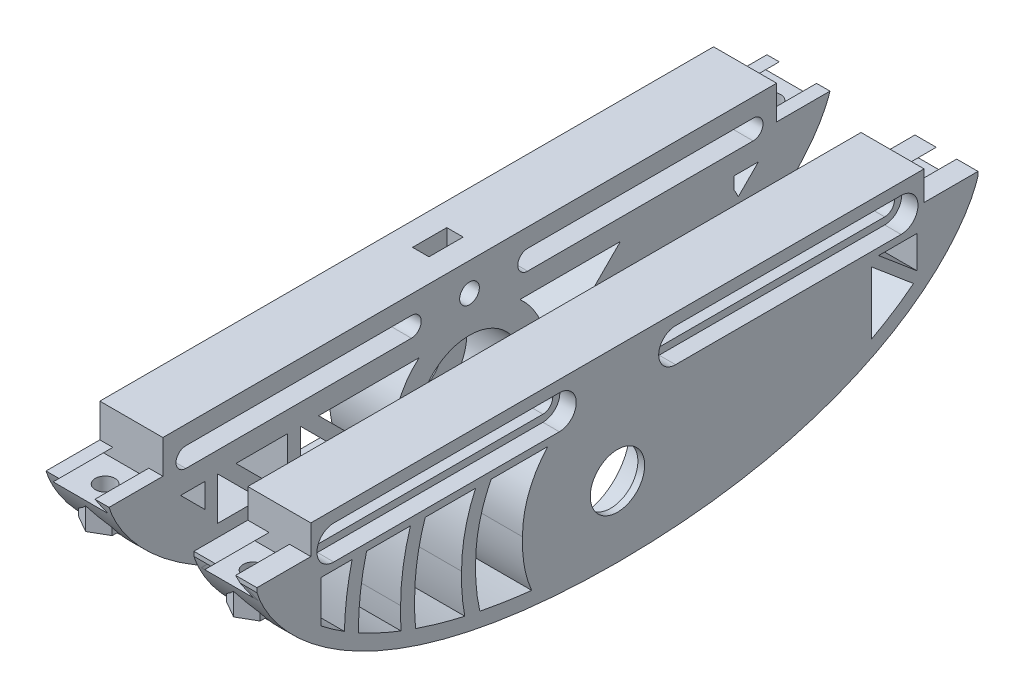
SolidWorks part; units mm, degrees
ref_plane "Front Plane" through (0, 0, 0) normal (0, 0, 1) x (1, 0, 0)
ref_plane "Top Plane" through (0, 0, 0) normal (0, 1, 0) x (1, 0, 0)
ref_plane "Right Plane" through (0, 0, 0) normal (1, 0, 0) x (0, 0, -1)
sketch "Sketch1" plane through (0, 0, 0) normal (0, 1, 0) x (1, 0, 0)
  line L0 (9.0549, 62.1087) -> (22.5, 62.1087) construction
  line L1 (-22.5, -77.5) -> (22.5, -77.5)
  line L2 (-22.5, -77.5) -> (-22.5, 77.5)
  line L3 (-22.5, 77.5) -> (22.5, 77.5)
  line L4 (22.5, -77.5) -> (22.5, 77.5)
  line L5 (-22.5, -77.5) -> (22.5, 77.5) construction
  line L6 (-22.5, 77.5) -> (22.5, -77.5) construction
  line L7 (-9.0549, -71) -> (9.0549, -71)
  line L8 (-9.0549, -71) -> (-9.0549, 71)
  line L9 (-9.0549, 71) -> (9.0549, 71)
  line L10 (9.0549, -71) -> (9.0549, 71)
  line L11 (-9.0549, -71) -> (9.0549, 71) construction
  line L12 (-9.0549, 71) -> (9.0549, -71) construction
  line L13 (22.5, 0) -> (30.5303, 0) construction
  line L14 (0, 71) -> (0, 63.7491) construction
  circle A0 centre (15.7774, 71) radius 2.1
  circle A1 centre (15.7774, -71) radius 2.1
  circle A2 centre (-15.7774, -71) radius 2.1
  circle A3 centre (-15.7774, 71) radius 2.1
  point P0 (0, 0)
  point P6 (0, 0)
  dimension "D4" = 4.2
  dimension "D1" = 45
  dimension "D2" = 155
  dimension "D3" = 142
extrude "Boss-Extrude1" add sketch "Sketch1" along normal blind 3.85
sketch "Sketch2" plane through (22.5, 0, 0) normal (1, 0, 0) x (0, 0, -1)
  line L0 (0, -36.15) -> (0, -37.8485) construction
  line L1 (0, -32.15) -> (-8.9497, -32.15) construction
  line L2 (-60.5001, -2.2123) -> (-12.3944, -2.2123) construction
  line L3 (-60.5001, -0.1123) -> (-12.3944, -0.1123)
  line L4 (-60.5001, -4.3123) -> (-12.3944, -4.3123)
  line L5 (0, 3.85) -> (0, 7.9942) construction
  line L6 (-77.5, 3.85) -> (77.5, 3.85) construction
  line L7 (60.5001, -2.2123) -> (12.3944, -2.2123) construction
  line L8 (60.5001, -0.1123) -> (12.3944, -0.1123)
  line L9 (60.5001, -4.3123) -> (12.3944, -4.3123)
  line L10 (61.6288, -8.735) -> (56.4489, -13.9148)
  line L11 (-10.743, -8.735) -> (-32.1809, -8.735)
  line L12 (-32.1809, -8.735) -> (-15.8727, -25.0432)
  line L13 (-36.07, -8.735) -> (-18.3961, -26.4088)
  line L14 (-18.3961, -26.4088) -> (-36.07, -26.4088)
  line L15 (-36.07, -26.4088) -> (-36.07, -8.735)
  line L16 (-38.82, -8.735) -> (-38.82, -19.7248)
  line L17 (-38.82, -19.7248) -> (-49.8099, -8.735)
  line L18 (-49.8099, -8.735) -> (-38.82, -8.735)
  line L19 (-53.6989, -8.735) -> (-44.5827, -17.8512)
  line L20 (-44.5827, -17.8512) -> (-53.6989, -17.8512)
  line L21 (-53.6989, -17.8512) -> (-53.6989, -8.735)
  line L22 (-56.4489, -13.9148) -> (-56.4489, -8.735)
  line L23 (-56.4489, -8.735) -> (-61.6288, -8.735)
  line L24 (-61.6288, -8.735) -> (-56.4489, -13.9148)
  line L25 (-32.1809, -8.735) -> (-80.3886, -8.735) construction
  line L26 (56.4489, -13.9148) -> (56.4489, -8.735)
  line L27 (53.6989, -17.8512) -> (53.6989, -8.735)
  line L28 (44.5827, -17.8512) -> (53.6989, -17.8512)
  line L29 (53.6989, -8.735) -> (44.5827, -17.8512)
  line L30 (49.8099, -8.735) -> (38.82, -8.735)
  line L31 (38.82, -19.7248) -> (49.8099, -8.735)
  line L32 (38.82, -8.735) -> (38.82, -19.7248)
  line L33 (36.07, -26.4088) -> (36.07, -8.735)
  line L34 (18.3961, -26.4088) -> (36.07, -26.4088)
  line L35 (36.07, -8.735) -> (18.3961, -26.4088)
  line L36 (32.1809, -8.735) -> (15.8727, -25.0432)
  line L37 (10.743, -8.735) -> (32.1809, -8.735)
  line L38 (56.4489, -8.735) -> (61.6288, -8.735)
  circle A0 centre (0, -21.075) radius 11.075
  circle A1 centre (0, -2.2123) radius 2.1
  arc A2 (-60.5001, -0.1123) -> (-60.5001, -4.3123) centre (-60.5001, -2.2123) ccw
  arc A3 (-12.3944, -4.3123) -> (-12.3944, -0.1123) centre (-12.3944, -2.2123) ccw
  arc A4 (60.5001, -0.1123) -> (60.5001, -4.3123) centre (60.5001, -2.2123) cw
  arc A5 (12.3944, -4.3123) -> (12.3944, -0.1123) centre (12.3944, -2.2123) cw
  arc A6 (-10.743, -8.735) -> (-15.8727, -25.0432) centre (0, -21.075) ccw
  arc A7 (10.743, -8.735) -> (15.8727, -25.0432) centre (0, -21.075) cw
  spline S0 degree 3 poles (0, -36.15) (-57.8718, -36.025) (-77.0889, -10.6303) (-77.5, 0) knots 0 0 0 0 1 1 1 1
  spline S1 degree 3 poles (0, -36.15) (57.8718, -36.025) (77.0889, -10.6303) (77.5, 0) knots 0 0 0 0 1 1 1 1
  point P14 (-36.4473, -2.2123)
  point P25 (36.4473, -2.2123)
  dimension "D1" = 22.15
  dimension "D2" = 4.2
  dimension "D4" = 2.1
  dimension "D3" = 4
  dimension "D5" = 45
  dimension "D6" = 45
  dimension "D7" = 45
  dimension "D8" = 2.75
  dimension "D9" = 2.75
  dimension "D10" = 2.75
  dimension "D11" = 2.75
  dimension "D12" = 40
extrude "Boss-Extrude2" add sketch "Sketch2" against normal up to surface (31.5549 mm away) contours S0 S1 L11 A6 L12 L9 A5 L8 A4 L26 L38 L10 L20 L21 L19 L17 L18 L16 L14 L15 L13 L24 L23 L22 L29 L27 L28 L32 L30 L31 L35 L33 L34 A0 A1 A3 L4 M16
mirror "Mirror9" about plane through (0, 0, 0) normal (1, 0, 0) of "Boss-Extrude2"
sketch "Sketch4" plane through (0, 0, 0) normal (0, 1, 0) x (1, 0, 0)
  line L1 (9.0549, 71) -> (-9.0549, 71)
  line L2 (9.0549, 71) -> (9.0549, -71)
  line L3 (9.0549, -71) -> (-9.0549, -71)
  line L4 (-9.0549, 71) -> (-9.0549, -71)
  circle A0 centre (15.7774, -71) radius 2.1
  circle A1 centre (-15.7774, -71) radius 2.1
  circle A2 centre (15.7774, 71) radius 2.1
  circle A3 centre (-15.7774, 71) radius 2.1
extrude "Cut-Extrude1" cut sketch "Sketch4" against normal through all
sketch "Sketch5" plane through (0, 0, 77.5) normal (0, 0, 1) x (1, 0, 0)
  line L0 (-22.5, 0) -> (22.5, 0) construction
  line L1 (-9.0549, -13.0689) -> (9.0549, -13.0689)
  line L2 (-9.0549, -13.0689) -> (-9.0549, 0)
  line L3 (-9.0549, 0) -> (9.0549, 0)
  line L4 (9.0549, -13.0689) -> (9.0549, 0)
extrude "Cut-Extrude2" cut sketch "Sketch5" against normal through all
sketch "Sketch6" plane through (22.5, 0, 0) normal (1, 0, 0) x (0, 0, -1)
  line L0 (-60.5001, -2.2123) -> (-12.3944, -2.2123) construction
  line L1 (-60.5001, 1.3877) -> (-12.3944, 1.3877)
  line L2 (-60.5001, -5.8123) -> (-12.3944, -5.8123)
  line L3 (0, -0.1123) -> (0, -1.2356) construction
  line L4 (60.5001, -2.2123) -> (12.3944, -2.2123) construction
  line L5 (60.5001, 1.3877) -> (12.3944, 1.3877)
  line L6 (60.5001, -5.8123) -> (12.3944, -5.8123)
  arc A0 (-60.5001, 1.3877) -> (-60.5001, -5.8123) centre (-60.5001, -2.2123) ccw
  arc A1 (-12.3944, -5.8123) -> (-12.3944, 1.3877) centre (-12.3944, -2.2123) ccw
  circle A2 centre (0, -2.2123) radius 2.1 construction
  arc A3 (60.5001, 1.3877) -> (60.5001, -5.8123) centre (60.5001, -2.2123) cw
  arc A4 (12.3944, -5.8123) -> (12.3944, 1.3877) centre (12.3944, -2.2123) cw
  point P4 (-36.4473, -2.2123)
  point P16 (36.4473, -2.2123)
  dimension "D1" = 3.6
extrude "Cut-Extrude3" cut sketch "Sketch6" against normal blind 3.5
ref_plane "Plane1" through (0, -35, 0) normal (0, -1, 0) x (-1, 0, 0)
ref_plane "Plane2" through (0, -1.15, 0) normal (0, 1, 0) x (1, 0, 0)
mirror "Mirror10" about plane through (0, 0, 0) normal (1, 0, 0) of "Cut-Extrude3"
sketch "Sketch11" plane through (0, -35, 0) normal (0, -1, 0) x (-1, 0, 0)
  line L0 (0, 77.5) -> (0, 63.1693) construction
  line L1 (15.7774, 75.1569) -> (12.1774, 73.0785)
  line L2 (12.1774, 73.0785) -> (12.1774, 68.9215)
  line L3 (12.1774, 68.9215) -> (15.7774, 66.8431)
  line L4 (15.7774, 66.8431) -> (19.3774, 68.9215)
  line L5 (19.3774, 68.9215) -> (19.3774, 73.0785)
  line L6 (19.3774, 73.0785) -> (15.7774, 75.1569)
  line L7 (-9.0549, 77.5) -> (9.0549, 77.5) construction
  line L8 (-19.3774, 73.0785) -> (-15.7774, 75.1569)
  line L9 (-19.3774, 68.9215) -> (-19.3774, 73.0785)
  line L10 (-15.7774, 66.8431) -> (-19.3774, 68.9215)
  line L11 (-12.1774, 68.9215) -> (-15.7774, 66.8431)
  line L12 (-12.1774, 73.0785) -> (-12.1774, 68.9215)
  line L13 (-15.7774, 75.1569) -> (-12.1774, 73.0785)
  line L14 (-9.0549, 0) -> (-3.8252, 0) construction
  line L15 (-15.7774, -75.1569) -> (-12.1774, -73.0785)
  line L16 (-12.1774, -73.0785) -> (-12.1774, -68.9215)
  line L17 (-12.1774, -68.9215) -> (-15.7774, -66.8431)
  line L18 (-15.7774, -66.8431) -> (-19.3774, -68.9215)
  line L19 (-19.3774, -68.9215) -> (-19.3774, -73.0785)
  line L20 (-19.3774, -73.0785) -> (-15.7774, -75.1569)
  line L21 (19.3774, -73.0785) -> (15.7774, -75.1569)
  line L22 (19.3774, -68.9215) -> (19.3774, -73.0785)
  line L23 (15.7774, -66.8431) -> (19.3774, -68.9215)
  line L24 (12.1774, -68.9215) -> (15.7774, -66.8431)
  line L25 (12.1774, -73.0785) -> (12.1774, -68.9215)
  line L26 (15.7774, -75.1569) -> (12.1774, -73.0785)
  circle A0 centre (15.7774, 71) radius 3.6 construction
  dimension "D1" = 7.2
extrude "Cut-Extrude5" cut sketch "Sketch11" against normal blind 23
sketch "Sketch12" plane through (0, -12, 0) normal (0, -1, 0) x (1, 0, 0)
  line L1 (-15.7774, 66.8431) -> (-12.1774, 68.9215)
  line L2 (-12.1774, 68.9215) -> (-12.1774, 73.0785)
  line L3 (-12.1774, 73.0785) -> (-15.7774, 75.1569)
  line L4 (-15.7774, 75.1569) -> (-19.3774, 73.0785)
  line L5 (-19.3774, 73.0785) -> (-19.3774, 68.9215)
  line L6 (-19.3774, 68.9215) -> (-15.7774, 66.8431)
  line L7 (15.7774, 66.8431) -> (19.3774, 68.9215)
  line L8 (19.3774, 68.9215) -> (19.3774, 73.0785)
  line L9 (19.3774, 73.0785) -> (15.7774, 75.1569)
  line L10 (15.7774, 75.1569) -> (12.1774, 73.0785)
  line L11 (12.1774, 73.0785) -> (12.1774, 68.9215)
  line L12 (12.1774, 68.9215) -> (15.7774, 66.8431)
  line L13 (-15.7774, -66.8431) -> (-19.3774, -68.9215)
  line L14 (-19.3774, -68.9215) -> (-19.3774, -73.0785)
  line L15 (-19.3774, -73.0785) -> (-15.7774, -75.1569)
  line L16 (-15.7774, -75.1569) -> (-12.1774, -73.0785)
  line L17 (-12.1774, -73.0785) -> (-12.1774, -68.9215)
  line L18 (-12.1774, -68.9215) -> (-15.7774, -66.8431)
  line L19 (15.7774, -66.8431) -> (12.1774, -68.9215)
  line L20 (12.1774, -68.9215) -> (12.1774, -73.0785)
  line L21 (12.1774, -73.0785) -> (15.7774, -75.1569)
  line L22 (15.7774, -75.1569) -> (19.3774, -73.0785)
  line L23 (19.3774, -73.0785) -> (19.3774, -68.9215)
  line L24 (19.3774, -68.9215) -> (15.7774, -66.8431)
  circle A0 centre (-15.7774, 71) radius 3.6 construction
  circle A1 centre (15.7774, 71) radius 3.6 construction
  circle A2 centre (-15.7774, -71) radius 3.6 construction
  circle A3 centre (15.7774, -71) radius 3.6 construction
  circle A4 centre (-15.7774, 71) radius 2.1
  circle A5 centre (15.7774, 71) radius 2.1
  circle A6 centre (15.7774, -71) radius 2.1
  circle A7 centre (-15.7774, -71) radius 2.1
  circle A8 centre (-15.7774, -71) radius 2.1 construction
extrude "Boss-Extrude4" add sketch "Sketch12" against normal blind 5
ref_plane "Plane3" through (14.0549, 0, 0) normal (-1, 0, 0) x (0, 0, 1)
sketch "Sketch14" plane through (14.0549, 0, 0) normal (-1, 0, 0) x (0, 0, 1)
  line L0 (-3.65, -0.105) -> (-3.65, 5.4565)
  line L1 (-3.65, 5.4565) -> (3.65, 5.4565)
  line L2 (-3.65, -0.105) -> (-3.65, -4.3196)
  line L3 (-3.65, -4.3196) -> (0, -6.427)
  line L4 (0, -6.427) -> (3.65, -4.3196)
  line L5 (3.65, -4.3196) -> (3.65, -1.0287)
  line L6 (3.65, 5.4565) -> (3.65, -1.0287)
  line L7 (0, 2.0024) -> (-2.85, 0.3569)
  line L8 (3.65, -0.105) -> (0.8, 1.5405)
  dimension "D1" = 7.3
extrude "Cut-Extrude6" cut sketch "Sketch14" against normal blind 3.5
mirror "Mirror11" about plane through (0, 0, 0) normal (1, 0, 0) of "Cut-Extrude6"
sketch "Sketch15" plane through (22.5, 0, 0) normal (1, 0, 0) x (0, 0, -1)
  circle A0 centre (0, -2.2123) radius 3.6
extrude "Cut-Extrude7" cut sketch "Sketch15" against normal blind 3
mirror "Mirror12" about plane through (0, 0, 0) normal (1, 0, 0) of "Cut-Extrude7"
sketch "Sketch16" plane through (-22.5, 0, 0) normal (-1, 0, 0) x (0, 0, 1)
  circle A0 centre (0, -21.075) radius 11.075
  circle A1 centre (0, -21.075) radius 5.8
  dimension "D1" = 11.6
extrude "Boss-Extrude5" add sketch "Sketch16" against normal blind 1.75
mirror "Mirror13" about plane through (0, 0, 0) normal (1, 0, 0) of "Boss-Extrude5"
sketch "Sketch17" plane through (9.0549, 0, 0) normal (1, 0, 0) x (0, 0, -1)
  circle A0 centre (0, -21.075) radius 13.9
  dimension "D1" = 27.8
extrude "Cut-Extrude9" cut sketch "Sketch17" along normal blind 4
sketch "Sketch19" plane through (9.0549, 0, 0) normal (-1, 0, 0) x (0, 0, 1)
  line L0 (-77.5, 3.85) -> (77.5, 3.85) construction
  arc A0 (-32.1871, -26.1613) -> (-32.485, -18.077) centre (-21.2404, -21.7103) ccw
  arc A1 (-32.485, -18.077) -> (-32.1871, -26.1613) centre (-38.3696, -22.3415) ccw
  dimension "D1" = 25.5603
  dimension "D2" = 26.1915
extrude "Cut-Extrude10" cut sketch "Sketch19" against normal blind 5
sketch "Sketch20" plane through (14.0549, 0, 0) normal (-1, 0, 0) x (0, 0, 1)
  circle A0 centre (-38.3696, -22.3415) radius 3.3
extrude "Cut-Extrude11" cut sketch "Sketch20" against normal through all
sketch "Sketch22" plane through (22.5, 0, 0) normal (1, 0, 0) x (0, 0, -1)
  line L0 (10.0779, -8.3707) -> (15.7278, -27.7205)
  line L1 (15.7278, -27.7205) -> (43.3492, -26.6496)
  line L2 (43.3492, -26.6496) -> (47.2635, -20.5566)
  line L3 (47.2635, -20.5566) -> (43.3492, -17.4917)
  line L4 (43.3492, -17.4917) -> (52.9133, -7.3367)
  line L5 (52.9133, -7.3367) -> (10.0779, -8.3707)
  circle A0 centre (38.3696, -22.3415) radius 2.15
  circle A1 centre (21.2404, -21.7103) radius 2.15
  dimension "D1" = 4.3
  dimension "D2" = 4.3
extrude "Boss-Extrude6" add sketch "Sketch22" against normal up to surface (8.4451 mm away)
sketch "Sketch23" plane through (9.0549, 0, 0) normal (-1, 0, 0) x (0, 0, 1)
  line L0 (-49.8099, -8.735) -> (-42.3098, -16.235)
  line L3 (-38.82, -15.0881) -> (-38.82, -8.735)
  line L4 (-38.82, -8.735) -> (-49.8099, -8.735)
  line L5 (-36.07, -8.735) -> (-36.07, -15.4476)
  line L6 (-36.07, -8.735) -> (-30.4719, -14.3332)
  line L7 (-32.1809, -8.735) -> (-28.5167, -12.3992)
  line L8 (-32.1809, -8.735) -> (-10.743, -8.735)
  line L9 (-10.743, -8.735) -> (-13.9019, -12.4481)
  line L10 (-13.9019, -12.4481) -> (-13.9021, -12.4479)
  arc A0 (-13.9021, -12.4479) -> (-28.5167, -12.3992) centre (-21.2404, -21.7103) ccw
  arc A1 (-32.485, -18.077) -> (-36.07, -15.4476) centre (-38.3696, -22.3415) ccw
  arc A2 (-30.4719, -14.3332) -> (-32.485, -18.077) centre (-21.2404, -21.7103) ccw
  arc A3 (-38.82, -15.0881) -> (-42.3098, -16.235) centre (-38.3696, -22.3415) ccw
extrude "Boss-Extrude7" add sketch "Sketch23" against normal blind 7
sketch "Sketch24" plane through (14.0549, 0, 0) normal (-1, 0, 0) x (0, 0, 1)
  circle A0 centre (-21.2404, -21.7103) radius 2.1
  dimension "D1" = 4.2
extrude "Cut-Extrude12" cut sketch "Sketch24" against normal through all
sketch "Sketch25" plane through (-22.5, 0, 0) normal (-1, 0, 0) x (0, 0, 1)
  line L0 (-49.5928, -31.4481) -> (-47.2256, -23.6358)
  line L1 (-49.1564, -31.2147) -> (-46.8677, -23.6618) construction
  line L2 (-38.3696, -22.3415) -> (-42.1319, -34.7574) construction
  line L3 (-34.089, -36.1461) -> (-31.7217, -28.3338)
  line L4 (-34.3224, -35.7096) -> (-32.0338, -28.1567) construction
  line L5 (-49.1564, -31.2147) -> (-34.3224, -35.7096) construction
  line L6 (-49.5928, -31.4481) -> (-34.089, -36.1461)
  arc A0 (-32.0338, -28.1567) -> (-46.8677, -23.6618) centre (-38.3696, -22.3415) ccw construction
  arc A1 (-31.7217, -28.3338) -> (-47.2256, -23.6358) centre (-38.3696, -22.3415) ccw
  point P7 (-46.1668, -21.3489)
  dimension "D1" = 0.35
extrude "Cut-Extrude13" cut sketch "Sketch25" against normal blind 11 contours A1 L0 L3 M40 M35 M36 M32 M33 M10 M39 | A1 M39 M40 | A1 M35 M36 | L0 L6 L3 M10
sketch "Sketch26" plane through (-22.5, 0, 0) normal (-1, 0, 0) x (0, 0, 1)
  circle A0 centre (-46.2, -17.878) radius 3.55
  dimension "D1" = 7.1
extrude "Cut-Extrude14" cut sketch "Sketch26" against normal blind 20
sketch "Sketch27" plane through (-22.5, 0, 0) normal (-1, 0, 0) x (0, 0, 1)
  line L1 (-36.07, -8.735) -> (-18.3961, -26.4088) construction
  line L2 (-18.3961, -26.4088) -> (-30.3972, -26.4088) construction
  line L3 (-27.233, -26.4088) -> (-18.3961, -26.4088)
  line L4 (-18.3961, -26.4088) -> (-27.233, -17.5719)
  line L5 (-46.1117, -17.8512) -> (-47.7713, -17.8512)
  line L6 (-49.7499, -17.8512) -> (-53.6989, -17.8512) construction
  line L7 (-30.3972, -26.4088) -> (-28.7774, -26.4088)
  line L8 (-36.07, -12.1795) -> (-36.07, -8.735)
  line L10 (-36.07, -8.735) -> (-27.233, -17.5719)
  line L11 (-28.7774, -26.4088) -> (-27.233, -26.4088)
  arc A1 (-36.07, -12.1795) -> (-47.7713, -17.8512) centre (-38.3696, -22.3415) ccw
  arc A2 (-30.3972, -26.4088) -> (-46.1117, -17.8512) centre (-38.3696, -22.3415) ccw
extrude "Boss-Extrude8" add sketch "Sketch27" against normal up to surface (13.4451 mm away)
sketch "Sketch28" plane through (-9.0549, 0, 0) normal (1, 0, 0) x (0, 0, -1)
  line L0 (43.5424, -29.7133) -> (39.456, -27.9605)
  circle A0 centre (46.2, -17.878) radius 3.5491
  arc A1 (43.5424, -29.7133) -> (39.456, -27.9605) centre (46.2, -17.878) ccw
extrude "Boss-Extrude9" add sketch "Sketch28" against normal up to surface (2.4451 mm away)
ref_plane "Plane4" through (0, 0, 0) normal (0, -1, 0) x (-1, 0, 0)
sketch "Sketch30" plane through (0, 0, 77.5) normal (0, 0, 1) x (1, 0, 0)
  line L0 (9.0549, -3.3067) -> (12.0549, -3.3067)
  line L1 (9.0549, 0) -> (9.0549, -36.15) construction
  line L2 (12.0549, -3.3067) -> (10.0549, -5.3067)
  line L3 (10.0549, -5.3067) -> (21.7246, -5.3067)
  line L4 (15.8897, -5.3067) -> (15.8897, -6.096) construction
  line L5 (9.0549, -3.3067) -> (-9.0549, -3.3067)
  line L6 (0, -3.3067) -> (0, -1.2227) construction
  line L7 (31.7795, -3.3067) -> (31.7795, 7.5471)
  line L8 (22.7246, -3.3067) -> (31.7795, -3.3067)
  line L9 (19.7246, -3.3067) -> (21.7246, -5.3067)
  line L10 (22.7246, -3.3067) -> (19.7246, -3.3067)
  line L11 (-31.7795, 7.5471) -> (31.7795, 7.5471)
  line L12 (-22.7246, -3.3067) -> (-19.7246, -3.3067)
  line L13 (-19.7246, -3.3067) -> (-21.7246, -5.3067)
  line L14 (-22.7246, -3.3067) -> (-31.7795, -3.3067)
  line L15 (-31.7795, -3.3067) -> (-31.7795, 7.5471)
  line L16 (-10.0549, -5.3067) -> (-21.7246, -5.3067)
  line L17 (-12.0549, -3.3067) -> (-10.0549, -5.3067)
  line L18 (-9.0549, -3.3067) -> (-12.0549, -3.3067)
  point P18 (0, 7.5471)
  dimension "D1" = 3
  dimension "D2" = 45
  dimension "D3" = 2
extrude "Cut-Extrude16" cut sketch "Sketch30" against normal blind 12
sketch "Sketch31" plane through (0, 0, 65.5) normal (0, 0, 1) x (1, 0, 0)
  line L8 (-22.5, -3.3067) -> (-19.7246, -3.3067)
  line L9 (-22.5, -3.3067) -> (-19.7246, -3.3067)
  line L10 (-19.7246, -3.3067) -> (-21.7246, -5.3067)
  line L11 (-19.7246, -3.3067) -> (-21.7246, -5.3067)
  line L12 (-21.7246, -5.3067) -> (-10.0549, -5.3067)
  line L13 (-21.7246, -5.3067) -> (-10.0549, -5.3067)
  line L14 (-10.0549, -5.3067) -> (-12.0549, -3.3067)
  line L15 (-10.0549, -5.3067) -> (-12.0549, -3.3067)
  line L16 (-12.0549, -3.3067) -> (-9.0549, -3.3067)
  line L17 (-12.0549, -3.3067) -> (-9.0549, -3.3067)
  line L18 (-9.0549, -3.3067) -> (-9.0549, 3.85)
  line L19 (-9.0549, -3.3067) -> (-9.0549, 3.85)
  line L20 (-9.0549, 3.85) -> (-22.5, 3.85)
  line L21 (-9.0549, 3.85) -> (-22.5, 3.85)
  line L22 (-22.5, 3.85) -> (-22.5, -3.3067)
  line L23 (-22.5, 3.85) -> (-22.5, -3.3067)
  line L48 (22.5, 3.85) -> (9.0549, 3.85)
  line L49 (9.0549, 3.85) -> (9.0549, -3.3067)
  line L50 (9.0549, -3.3067) -> (12.0549, -3.3067)
  line L51 (12.0549, -3.3067) -> (10.0549, -5.3067)
  line L52 (10.0549, -5.3067) -> (21.7246, -5.3067)
  line L53 (21.7246, -5.3067) -> (19.7246, -3.3067)
  line L54 (19.7246, -3.3067) -> (22.5, -3.3067)
  line L55 (22.5, -3.3067) -> (22.5, 3.85)
  dimension "D1" = 0
extrude "Cut-Extrude17" cut sketch "Sketch31" against normal blind 0.1
mirror "Mirror14" about plane through (0, 0, 0) normal (0, 0, 1) of "Cut-Extrude17", "Cut-Extrude16"
sketch "Sketch33" plane through (0, 0, 65.4) normal (0, 0, 1) x (1, 0, 0)
  line L0 (12.0549, -3.3067) -> (10.0549, -5.3067) construction
  line L1 (10.0549, -5.3067) -> (21.7246, -5.3067) construction
  line L2 (21.7246, -5.3067) -> (19.7246, -3.3067) construction
  line L3 (19.7246, -3.3067) -> (12.0549, -3.3067) construction
  line L4 (12.0135, -3.2067) -> (9.8135, -5.4067)
  line L5 (9.8135, -5.4067) -> (21.966, -5.4067)
  line L6 (21.966, -5.4067) -> (19.766, -3.2067)
  line L7 (19.766, -3.2067) -> (12.0135, -3.2067)
  line L8 (-19.7246, -3.3067) -> (-21.7246, -5.3067) construction
  line L9 (-21.7246, -5.3067) -> (-19.7246, -3.3067) construction
  line L10 (-19.7246, -3.3067) -> (-21.7246, -5.3067) construction
  line L11 (-21.7246, -5.3067) -> (-10.0549, -5.3067) construction
  line L12 (-21.7246, -5.3067) -> (-10.0549, -5.3067) construction
  line L13 (-10.0549, -5.3067) -> (-12.0549, -3.3067) construction
  line L14 (-12.0549, -3.3067) -> (-19.7246, -3.3067) construction
  line L15 (-19.766, -3.2067) -> (-21.966, -5.4067)
  line L16 (-21.966, -5.4067) -> (-9.8135, -5.4067)
  line L17 (-9.8135, -5.4067) -> (-12.0135, -3.2067)
  line L18 (-12.0135, -3.2067) -> (-19.766, -3.2067)
  dimension "D1" = 0.1
  dimension "D2" = 0.1
extrude "Cut-Extrude19" cut sketch "Sketch33" along normal through all
sketch "Sketch34" plane through (0, 0, -65.4) normal (0, 0, -1) x (-1, 0, 0)
  line L0 (-19.7246, -3.3067) -> (-21.7246, -5.3067) construction
  line L1 (-21.7246, -5.3067) -> (-10.0549, -5.3067) construction
  line L2 (-10.0549, -5.3067) -> (-12.0549, -3.3067) construction
  line L3 (-12.0549, -3.3067) -> (-19.7246, -3.3067) construction
  line L4 (-19.766, -3.2067) -> (-21.966, -5.4067)
  line L5 (-21.966, -5.4067) -> (-9.8135, -5.4067)
  line L6 (-9.8135, -5.4067) -> (-12.0135, -3.2067)
  line L7 (-12.0135, -3.2067) -> (-19.766, -3.2067)
  line L8 (0, 0) -> (0, -9.5107) construction
  line L9 (12.0549, -3.3067) -> (19.7246, -3.3067) construction
  line L10 (10.0549, -5.3067) -> (12.0549, -3.3067) construction
  line L11 (21.7246, -5.3067) -> (10.0549, -5.3067) construction
  line L12 (19.7246, -3.3067) -> (21.7246, -5.3067) construction
  line L13 (12.0135, -3.2067) -> (19.766, -3.2067)
  line L14 (9.8135, -5.4067) -> (12.0135, -3.2067)
  line L15 (21.966, -5.4067) -> (9.8135, -5.4067)
  line L16 (19.766, -3.2067) -> (21.966, -5.4067)
  dimension "D1" = 0.1
extrude "Cut-Extrude20" cut sketch "Sketch34" along normal through all
sketch "Sketch35" plane through (-9.0549, 0, 0) normal (1, 0, 0) x (0, 0, -1)
  circle A0 centre (0, -21.075) radius 11.125
  dimension "D1" = 22.25
extrude "Cut-Extrude21" cut sketch "Sketch35" against normal up to surface (11.6951 mm away)
sketch "Sketch36" plane through (9.0549, 0, 0) normal (-1, 0, 0) x (0, 0, 1)
  line L0 (-66.8431, -17.1657) -> (-66.8431, -7.3359)
  line L1 (-66.8431, -7.3359) -> (-7.2271, -7.3359)
  line L2 (-7.2271, -7.3359) -> (-7.2271, 3.85)
  line L3 (65.4, 3.85) -> (-65.4, 3.85) construction
  line L4 (-7.2271, 3.85) -> (6.2314, 3.85)
  line L5 (6.2314, 3.85) -> (6.2314, -6.7621)
  line L6 (6.2314, -6.7621) -> (66.8431, -6.7621)
  line L7 (66.8431, -6.7621) -> (66.8431, -17.1657)
  circle A0 centre (0, -21.075) radius 5.8
  spline S10 degree 3 poles (2261.7457, 1903.6377) (-1680.5557, -2474.0717) (858.9722, 2820.7545) (-411.8292, -2970.9066) knots -3.112131 -3.112131 -3.112131 -3.112131 4.921749 4.921749 4.921749 4.921749 only from (0, -36.15) to (-76.8845, -3.3067)
  spline S11 degree 3 poles (411.8391, -2970.952) (-858.9761, 2820.7397) (1680.5287, -2474.0055) (-2261.659, 1903.5415) knots -4.014513 -4.014513 -4.014513 -4.014513 4.019329 4.019329 4.019329 4.019329 only from (76.8845, -3.3067) to (0, -36.15)
  spline S12 degree 3 poles (0, -36.15) (-34.8619, -36.0747) (-55.6966, -26.8294) (-66.8431, -17.1657) knots 0 0 0 0 0.602399 0.602399 0.602399 0.602399
  spline S13 degree 3 poles (66.8431, -17.1657) (55.6966, -26.8294) (34.8619, -36.0747) (0, -36.15) knots 0.304858 0.304858 0.304858 0.304858 0.907257 0.907257 0.907257 0.907257
  dimension "D1" = 0
extrude "Boss-Extrude11" add sketch "Sketch36" against normal through all
sketch "Sketch37" plane through (9.0549, 0, 0) normal (-1, 0, 0) x (0, 0, 1)
  line L0 (-27.75, -5.0506) -> (0, -5.825)
  line L1 (-48.4215, -12.8466) -> (-32.3936, -5.7698)
  line L2 (-51.7, -17.878) -> (-51.7, -29.4687)
  line L3 (-0.5281, -36.3159) -> (-48.8804, -35.4784)
  line L4 (-48.8804, -35.4784) -> (-51.7, -29.4687)
  line L5 (-0.5281, -36.3159) -> (3.784, -39.6821)
  line L6 (3.784, -39.6821) -> (9.1988, -36.0862)
  arc A0 (15.2477, -21.3391) -> (0, -5.825) centre (0, -21.075) ccw
  arc A2 (-48.4215, -12.8466) -> (-51.7, -17.878) centre (-46.2, -17.878) ccw
  arc A3 (-27.75, -5.0506) -> (-32.3936, -5.7698) centre (-27.75, -20.4006) ccw
  spline S0 degree 2 poles (15.2477, -21.3391) (15.5752, -30.729) (9.1988, -36.0862) knots 0 0 0 1 1 1
  dimension "D1" = 30.5
  dimension "D2" = 27.75
  dimension "D3" = 15.35
  dimension "D5" = 11
  dimension "D4" = 18.45
extrude "Cut-Extrude22" cut sketch "Sketch37" against normal blind 5 contours L0 A3 L1 A2 L2 A0 M1 M2 M12 | L3 A0 L2 L4 M2 M1
sketch "Sketch38" plane through (14.0549, 0, 0) normal (-1, 0, 0) x (0, 0, 1)
  circle A0 centre (-27.75, -20.4006) radius 2.2
  circle A1 centre (-46.2, -17.878) radius 2.2
  dimension "D1" = 4.4
  dimension "D2" = 4.4
extrude "Cut-Extrude23" cut sketch "Sketch38" against normal through all
sketch "Sketch39" plane through (14.0549, 0, 0) normal (-1, 0, 0) x (0, 0, 1)
  circle A0 centre (0, -21.075) radius 11.125
  dimension "D1" = 22.25
extrude "Cut-Extrude24" cut sketch "Sketch39" against normal blind 7
sketch "Sketch40" plane through (9.0549, 0, 0) normal (-1, 0, 0) x (0, 0, 1)
  line L0 (30.268, -7.3123) -> (41.0018, -7.3123)
  line L1 (63.2575, -7.3123) -> (63.2575, -16.2414)
  line L2 (18.2915, -32.1658) -> (20.2488, -21.2915) construction
  line L3 (14.8543, -7.3123) -> (26.9379, -7.3123)
  line L4 (55.6905, -38.8974) -> (58.0662, -25.699) construction
  line L5 (56.6008, -7.3123) -> (63.2575, -7.3123)
  line L6 (44.1548, -7.3123) -> (53.5084, -7.3123)
  line L7 (-54.151, -8.6203) -> (-54.151, -22.0185)
  line L8 (-63.9318, -7.3123) -> (-63.9318, -14.2503)
  line L9 (-63.9318, -7.3123) -> (-55.7024, -7.3123)
  line L10 (14.8543, -7.3123) -> (-84.4288, -7.3123) construction
  line L11 (-63.9318, -15.5583) -> (-54.151, -7.3123) construction
  line L13 (-63.1414, -16.1999) -> (-54.151, -8.6203)
  line L14 (-63.9318, -14.2503) -> (-55.7024, -7.3123)
  line L16 (-64.5763, -14.7937) -> (-54.7955, -6.5477) construction
  line L17 (-63.2872, -16.3228) -> (-53.5064, -8.0768) construction
  arc A0 (43.25, -21.0342) -> (41.0018, -7.3123) centre (0, -21.075) ccw
  arc A1 (30.2498, -21.184) -> (26.9379, -7.3123) centre (0, -21.075) ccw
  arc A2 (46.2499, -20.9988) -> (44.1548, -7.3123) centre (0, -21.075) ccw
  arc A3 (20.2488, -21.2915) -> (14.8543, -7.3123) centre (0, -21.075) ccw
  arc A4 (33.2499, -21.1501) -> (30.268, -7.3123) centre (0, -21.075) ccw
  arc A5 (33.2498, -21.1949) -> (29.6094, -5.9474) centre (0, -21.075) ccw construction
  arc A6 (55.2497, -20.8917) -> (53.5084, -7.3123) centre (0, -21.075) ccw
  arc A7 (58.2353, -19.7682) -> (56.6008, -7.3123) centre (0, -21.075) ccw
  arc A9 (58.0662, -25.699) -> (42.7291, 18.514) centre (0, -21.075) ccw construction
  arc A10 (55.2497, -20.8917) -> (40.5284, 16.4751) centre (0, -21.075) ccw construction
  arc A11 (30.2498, -21.184) -> (22.1898, -0.5159) centre (0, -21.075) ccw construction
  arc A12 (43.25, -21.0342) -> (31.7259, 8.3194) centre (0, -21.075) ccw construction
  arc A13 (46.2499, -20.9988) -> (33.9265, 10.3583) centre (0, -21.075) ccw construction
  spline S0 degree 1 poles (39.3171, -41.4891) (43.25, -21.0342) knots 0 0 1 1 construction
  spline S1 degree 3 poles (18.2915, -32.1658) (18.3888, -31.9465) (18.4824, -31.7253) (19.2054, -29.9329) (19.655, -28.2807) (20.204, -24.865) (20.3047, -23.1015) (20.2488, -21.2915) knots 0.464507 0.464507 0.464507 0.464507 0.5 0.5 0.75 0.75 1 1 1 1
  spline S2 degree 3 poles (29.3467, -30.4823) (25.8985, -31.1618) (22.2172, -31.7304) (18.2915, -32.1658) knots 0.834069 0.834069 0.834069 0.834069 0.929828 0.929828 0.929828 0.929828
  spline S3 degree 1 poles (27.4331, -36.2194) (30.2498, -21.184) knots 0 0 1 1 construction
  spline S4 degree 3 poles (39.3171, -41.4891) (39.69, -40.6482) (40.3861, -38.9343) (41.542, -35.4943) (42.5783, -31.1535) (43.108, -26.8682) (43.2686, -23.5048) (43.2686, -21.8606) (43.25, -21.0342) knots 0.464507 0.464507 0.464507 0.464507 0.529936 0.595365 0.726224 0.857082 0.922511 0.98794 0.98794 0.98794 0.98794 only from (43.06, -26.8445) to (43.25, -21.0342)
  spline S5 degree 3 poles (63.2575, -16.2414) (61.7567, -17.431) (60.0862, -18.6135) (58.2353, -19.7682) knots 0.393236 0.393236 0.393236 0.393236 0.486261 0.486261 0.486261 0.486261
  spline S6 degree 3 poles (27.4331, -36.2194) (27.9632, -35.0238) (28.8759, -32.5526) (30.0691, -27.5137) (30.3158, -23.7191) (30.2498, -21.184) knots 0.464507 0.464507 0.464507 0.464507 0.59662 0.728733 0.992959 0.992959 0.992959 0.992959 only from (29.3467, -30.4823) to (30.2498, -21.184)
  spline S7 degree 1 poles (42.0596, -42.7052) (46.2499, -20.9988) knots 0 0 1 1 construction
  spline S8 degree 3 poles (42.0596, -42.7052) (42.4571, -41.8088) (43.1995, -39.9812) (44.4308, -36.3181) (45.5336, -31.7028) (46.0967, -27.1601) (46.2681, -23.6039) (46.2691, -21.8707) (46.2499, -20.9988) knots 0.464507 0.464507 0.464507 0.464507 0.529834 0.595162 0.725816 0.856471 0.921798 0.987126 0.987126 0.987126 0.987126 only from (46.1547, -25.718) to (46.2499, -20.9988)
  spline S9 degree 1 poles (50.287, -46.3534) (55.2497, -20.8917) knots 0 0 1 1 construction
  spline S10 degree 3 poles (50.287, -46.3534) (50.7583, -45.2906) (51.6394, -43.1222) (53.097, -38.7902) (54.3994, -33.3515) (55.0627, -28.0361) (55.2667, -23.9011) (55.2705, -21.9001) (55.2497, -20.8917) knots 0.464507 0.464507 0.464507 0.464507 0.529587 0.594667 0.724827 0.854988 0.920068 0.985148 0.985148 0.985148 0.985148 only from (55.2596, -21.5112) to (55.2497, -20.8917)
  spline S11 degree 1 poles (30.1756, -37.4355) (33.2426, -20.8903) knots 0 0 1 1 construction
  spline S12 degree 3 poles (30.1756, -37.4355) (30.7635, -36.1095) (31.7749, -33.3619) (32.752, -29.1942) (33.2447, -25.0068) (33.2851, -22.2662) (33.2426, -20.8903) knots 0.464507 0.464507 0.464507 0.464507 0.59838 0.732254 0.866127 1 1 1 1 only from (32.5582, -29.803) to (33.2499, -21.1501)
  spline S13 degree 3 poles (-63.1414, -16.1999) (-60.6362, -18.1909) (-57.6563, -20.1626) (-54.151, -22.0185) knots 0.651274 0.651274 0.651274 0.651274 0.909831 0.909831 0.909831 0.909831
  spline S15 degree 3 poles (43.06, -26.8445) (41.415, -27.4089) (39.6947, -27.9461) (36.1881, -28.9321) (34.4092, -29.3838) (32.5582, -29.803) knots 0.693497 0.693497 0.693497 0.693497 0.75 0.75 0.803691 0.803691 0.803691 0.803691
  spline S16 degree 3 poles (55.2596, -21.5112) (52.5594, -22.9965) (49.5327, -24.4147) (46.1547, -25.718) knots 0.533729 0.533729 0.533729 0.533729 0.656989 0.656989 0.656989 0.656989
  dimension "D1" = 23
  dimension "D2" = 26
  dimension "D3" = 35
  dimension "D4" = 38
  dimension "D5" = 1
  dimension "D6" = 1
extrude "Cut-Extrude25" cut sketch "Sketch40" against normal through all
sketch "Sketch41" plane through (0, 0, 65.4) normal (0, 0, 1) x (1, 0, 0)
  line L16 (21.966, -5.4067) -> (19.866, -3.3067)
  line L17 (19.866, -3.3067) -> (22.5, -3.3067)
  line L18 (22.5, -3.3067) -> (22.5, 3.85)
  line L19 (22.5, 3.85) -> (9.0549, 3.85)
  line L20 (9.0549, 3.85) -> (9.0549, -3.3067)
  line L21 (9.0549, -3.3067) -> (11.9135, -3.3067)
  line L22 (11.9135, -3.3067) -> (9.8135, -5.4067)
  line L23 (9.8135, -5.4067) -> (21.966, -5.4067)
  line L24 (21.966, -5.4067) -> (19.866, -3.3067)
  line L25 (19.866, -3.3067) -> (22.5, -3.3067)
  line L26 (22.5, -3.3067) -> (22.5, 3.85)
  line L27 (22.5, 3.85) -> (9.0549, 3.85)
  line L28 (9.0549, 3.85) -> (9.0549, -3.3067)
  line L29 (9.0549, -3.3067) -> (11.9135, -3.3067)
  line L30 (11.9135, -3.3067) -> (9.8135, -5.4067)
  line L31 (9.8135, -5.4067) -> (21.966, -5.4067)
  dimension "D1" = 0
extrude "Boss-Extrude12" add sketch "Sketch41" along normal blind 11.5
sketch "Sketch42" plane through (0, 0, 76.9) normal (0, 0, 1) x (1, 0, 0)
  line L0 (10.5549, -5.4067) -> (13.5996, -2.362)
  line L1 (9.8135, -5.4067) -> (21.966, -5.4067) construction
  line L2 (13.5996, -2.362) -> (9.0549, -2.362)
  line L3 (9.0549, 3.85) -> (9.0549, -3.3067) construction
  line L4 (9.0549, -2.362) -> (9.0549, 3.85)
  line L5 (9.0549, 3.85) -> (22.5, 3.85)
  line L6 (22.5, 3.85) -> (9.0549, 3.85) construction
  line L7 (10.5549, -5.4067) -> (21, -5.4067)
  line L8 (15.7774, 3.85) -> (15.7774, -6.264) construction
  line L9 (9.0549, -3.3067) -> (9.0549, -35.8951) construction
  line L10 (22.5, -2.362) -> (22.5, 3.85)
  line L11 (17.9553, -2.362) -> (22.5, -2.362)
  line L12 (21, -5.4067) -> (17.9553, -2.362)
  line L13 (13.6774, -5.4067) -> (13.6774, 4.4577) construction
  line L14 (13.6774, -5.4067) -> (13.6774, -12) construction
  point P17 (15.7774, -5.4067)
  dimension "D1" = 45
  dimension "D2" = 1.5
extrude "Cut-Extrude26" cut sketch "Sketch42" against normal blind 11.5
sketch "Sketch43" plane through (22.5, 0, 0) normal (1, 0, 0) x (0, 0, -1)
  line L0 (-76.9, -2.362) -> (-76.8845, -3.3067)
  line L1 (-76.9, -2.362) -> (-78.1825, -2.362)
  line L2 (-78.1825, -2.362) -> (-78.1825, -7.6394)
  line L3 (-78.1825, -7.6394) -> (-75.1569, -7.2684)
  spline S2 degree 3 poles (2261.7457, 1903.6377) (-1680.5557, -2474.0717) (858.9722, 2820.7545) (-411.8292, -2970.9066) knots -3.112131 -3.112131 -3.112131 -3.112131 4.921749 4.921749 4.921749 4.921749 only from (0, -36.15) to (-76.8845, -3.3067)
  spline S3 degree 3 poles (-75.1569, -7.2684) (-75.929, -5.8714) (-76.4993, -4.5396) (-76.8845, -3.3067) knots 0.8126 0.8126 0.8126 0.8126 0.907257 0.907257 0.907257 0.907257
  dimension "D1" = 0
extrude "Cut-Extrude27" cut sketch "Sketch43" against normal through all
mirror "Mirror15" about plane through (0, 0, 0) normal (0, 0, 1) of "Cut-Extrude27", "Cut-Extrude26", "Boss-Extrude12"
sketch "Sketch44" plane through (22.5, 0, 0) normal (1, 0, 0) x (0, 0, -1)
  circle A0 centre (27.75, -20.4006) radius 2.2
  circle A1 centre (46.2, -17.878) radius 2.2
extrude "Boss-Extrude13" add sketch "Sketch44" against normal blind 1.75
